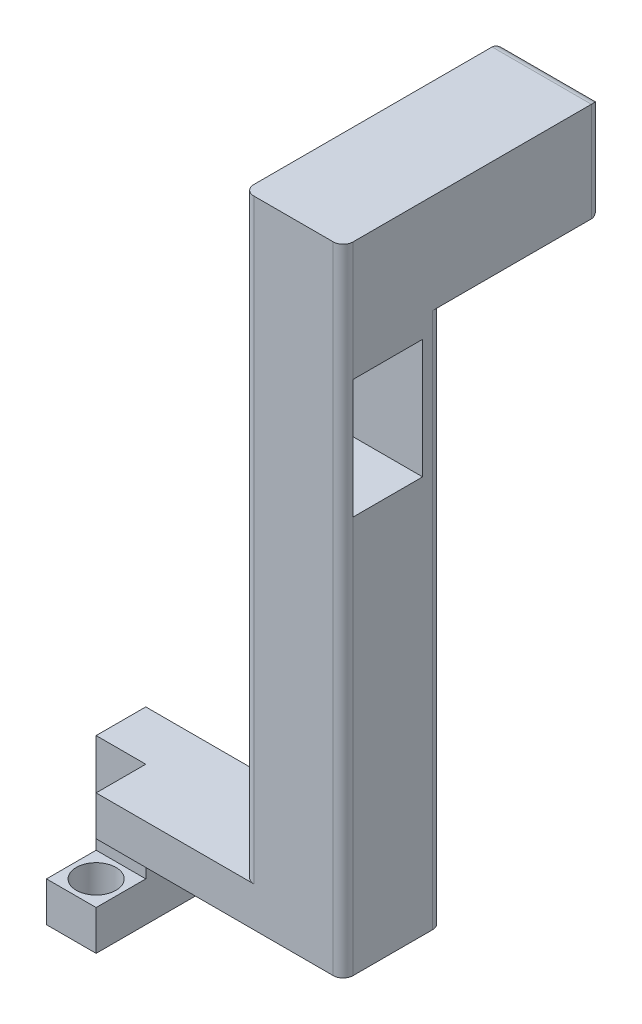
SolidWorks part; units mm, degrees
ref_plane "Front Plane" through (0, 0, 0) normal (0, 0, 1) x (1, 0, 0)
ref_plane "Top Plane" through (0, 0, 0) normal (0, 1, 0) x (1, 0, 0)
ref_plane "Right Plane" through (0, 0, 0) normal (1, 0, 0) x (0, 0, -1)
sketch "Sketch1" plane through (0, 0, 0) normal (0, 1, 0) x (1, 0, 0)
  line L1 (-7.47, 2.5) -> (7.47, 2.5)
  line L2 (-7.47, 2.5) -> (-7.47, -2.5)
  line L3 (-7.47, -2.5) -> (7.47, -2.5)
  line L4 (7.47, 2.5) -> (7.47, -2.5)
  line L5 (-7.47, 2.5) -> (7.47, -2.5) construction
  line L6 (-7.47, -2.5) -> (7.47, 2.5) construction
  point P0 (0, 0)
  dimension "D1" = 5
  dimension "D2" = 14.94
extrude "Boss-Extrude1" add sketch "Sketch1" along normal blind 2
sketch "Sketch5" plane through (0, 2, 0) normal (0, 1, 0) x (1, 0, 0)
  line L1 (7.47, -2.5) -> (2.47, -2.5)
  line L2 (7.47, -2.5) -> (7.47, 2.5)
  line L3 (7.47, 2.5) -> (2.47, 2.5)
  line L4 (2.47, -2.5) -> (2.47, 2.5)
  line L5 (7.47, -2.5) -> (2.47, 2.5) construction
  line L6 (-7.47, 2.5) -> (-7.47, -2.5)
  line L9 (-7.47, -2.5) -> (7.47, -2.5)
  line L10 (7.47, -2.5) -> (7.47, 2.5)
  line L11 (7.47, 2.5) -> (-7.47, 2.5)
  line L12 (-7.47, 2.5) -> (-7.47, -2.5)
  line L15 (-7.47, -2.5) -> (7.47, -2.5)
  line L16 (7.47, -2.5) -> (7.47, 2.5)
  line L17 (7.47, 2.5) -> (-7.47, 2.5)
  line L18 (7.47, 2.5) -> (2.47, -2.5) construction
  point P6 (4.97, 0)
  dimension "D2" = 5
  dimension "D1" = 0
extrude "Boss-Extrude3" add sketch "Sketch5" along normal blind 30 contours L4 M11 M12 M13
sketch "Sketch6" plane through (0, 0, -2.5) normal (0, 0, -1) x (-1, 0, 0)
  line L1 (-7.47, 32) -> (-2.47, 32)
  line L2 (-7.47, 32) -> (-7.47, 27)
  line L3 (-7.47, 27) -> (-2.47, 27)
  line L4 (-2.47, 32) -> (-2.47, 27)
  line L5 (-7.47, 32) -> (-2.47, 27) construction
  line L6 (-7.47, 0) -> (7.47, 0)
  line L7 (7.47, 0) -> (7.47, 2)
  line L8 (7.47, 2) -> (-2.47, 2)
  line L9 (-2.47, 2) -> (-2.47, 32)
  line L10 (-2.47, 32) -> (-7.47, 32)
  line L11 (-7.47, 32) -> (-7.47, 0)
  line L12 (-7.47, 0) -> (7.47, 0)
  line L13 (7.47, 0) -> (7.47, 2)
  line L14 (7.47, 2) -> (-2.47, 2)
  line L15 (-2.47, 2) -> (-2.47, 32)
  line L16 (-2.47, 32) -> (-7.47, 32)
  line L17 (-7.47, 32) -> (-7.47, 0)
  line L18 (-7.47, 27) -> (-2.47, 32) construction
  point P6 (-4.97, 29.5)
  dimension "D2" = 5
  dimension "D1" = 0
extrude "Boss-Extrude4" add sketch "Sketch6" along normal blind 8 contours L3 M13 M11 M12
fillet "Fillet1" radius 0.5 8 edges at (4.97, 27, -10.5) (4.97, 32, -10.5) (7.47, 29.5, -10.5) (2.47, 29.5, -10.5) (7.47, 13.5, -2.5) (2.47, 14.5, -2.5) (7.47, 16, 2.5) (2.47, 17, 2.5)
sketch "Sketch7" plane through (2.47, 0, 0) normal (-1, 0, 0) x (0, 0, 1)
  line L1 (-1.5, 20) -> (2, 20)
  line L2 (-1.5, 20) -> (-1.5, 26)
  line L3 (-1.5, 26) -> (2, 26)
  line L4 (2, 20) -> (2, 26)
  line L5 (-1.5, 20) -> (2, 26) construction
  line L6 (2, 32) -> (-10, 32)
  line L7 (-10, 32) -> (-10, 27)
  line L8 (-10, 27) -> (-2, 27)
  line L9 (-2, 27) -> (-2, 2)
  line L10 (-2, 2) -> (2, 2)
  line L11 (2, 2) -> (2, 32)
  line L12 (2, 32) -> (-10, 32)
  line L13 (-10, 32) -> (-10, 27)
  line L14 (-10, 27) -> (-2, 27)
  line L15 (-2, 27) -> (-2, 2)
  line L16 (-2, 2) -> (2, 2)
  line L17 (2, 2) -> (2, 32)
  line L18 (-1.5, 26) -> (2, 20) construction
  point P2 (0.25, 23)
  dimension "D2" = 3.5
  dimension "D3" = 6
  dimension "D4" = 6
  dimension "D1" = 0
extrude "Cut-Extrude3" cut sketch "Sketch7" against normal blind 8 contours L3 L2 L1 M14
sketch "Sketch8" plane through (0, 0, 0) normal (0, -1, 0) x (1, 0, 0)
  line L1 (-7.47, -2.5) -> (-4.97, -2.5)
  line L2 (-7.47, -2.5) -> (-7.47, 2.5)
  line L3 (-7.47, 2.5) -> (-4.97, 2.5)
  line L4 (-7.47, -2.5) -> (6.97, -2.5)
  line L5 (7.47, -2) -> (7.47, 2)
  line L6 (6.97, 2.5) -> (-7.47, 2.5)
  line L7 (-7.47, 2.5) -> (-7.47, -2.5)
  line L8 (-7.47, -2.5) -> (6.97, -2.5)
  line L9 (7.47, -2) -> (7.47, 2)
  line L10 (6.97, 2.5) -> (-7.47, 2.5)
  line L11 (-7.47, 2.5) -> (-7.47, -2.5)
  line L12 (-4.97, -2.5) -> (-4.97, 2.5)
  line L13 (-7.47, -2.5) -> (-4.97, 2.5) construction
  line L14 (-7.47, 2.5) -> (-4.97, -2.5) construction
  arc A2 (6.97, -2.5) -> (7.47, -2) centre (6.97, -2) ccw
  arc A3 (7.47, 2) -> (6.97, 2.5) centre (6.97, 2) ccw
  arc A4 (6.97, -2.5) -> (7.47, -2) centre (6.97, -2) ccw
  arc A5 (7.47, 2) -> (6.97, 2.5) centre (6.97, 2) ccw
  point P8 (-6.22, 0)
  dimension "D2" = 2.5
  dimension "D1" = 0
extrude "Boss-Extrude5" add sketch "Sketch8" along normal blind 5 contours L12 M8 M12 M13
sketch "Sketch9" plane through (-7.47, 0, 0) normal (-1, 0, 0) x (0, 0, 1)
  line L1 (2.5, 2) -> (0, 2)
  line L2 (2.5, 2) -> (2.5, -3)
  line L3 (2.5, -3) -> (0, -3)
  line L4 (-2.5, 2) -> (-2.5, -5)
  line L5 (-2.5, -5) -> (2.5, -5)
  line L6 (2.5, -5) -> (2.5, 2)
  line L7 (2.5, 2) -> (-2.5, 2)
  line L8 (-2.5, 2) -> (-2.5, -5)
  line L9 (-2.5, -5) -> (2.5, -5)
  line L10 (2.5, -5) -> (2.5, 2)
  line L11 (2.5, 2) -> (-2.5, 2)
  line L12 (0, 2) -> (0, -3)
  line L13 (2.5, 2) -> (0, -3) construction
  line L14 (2.5, -3) -> (0, 2) construction
  point P7 (1.25, -0.5)
  dimension "D2" = 5
  dimension "D3" = 2.5
  dimension "D1" = 0
extrude "Cut-Extrude4" cut sketch "Sketch9" against normal blind 2.5 contours L12 L3 M10 M9
sketch "Sketch10" plane through (0, -3, 0) normal (0, 1, 0) x (1, 0, 0)
  line L0 (-7.47, -1.25) -> (-4.97, -1.25) construction
  line L4 (-7.47, 0) -> (-7.47, -2.5)
  line L5 (-7.47, -2.5) -> (-4.97, -2.5)
  line L6 (-4.97, -2.5) -> (-4.97, 0)
  line L7 (-4.97, 0) -> (-7.47, 0)
  line L8 (-7.47, 0) -> (-7.47, -2.5)
  line L9 (-7.47, -2.5) -> (-4.97, -2.5)
  line L10 (-4.97, -2.5) -> (-4.97, 0)
  line L11 (-4.97, 0) -> (-7.47, 0)
  circle A0 centre (-6.22, -1.25) radius 1
  dimension "D1" = 0
extrude "Cut-Extrude5" cut sketch "Sketch10" against normal blind 2.5 contours A0 L0 | L0 A0
